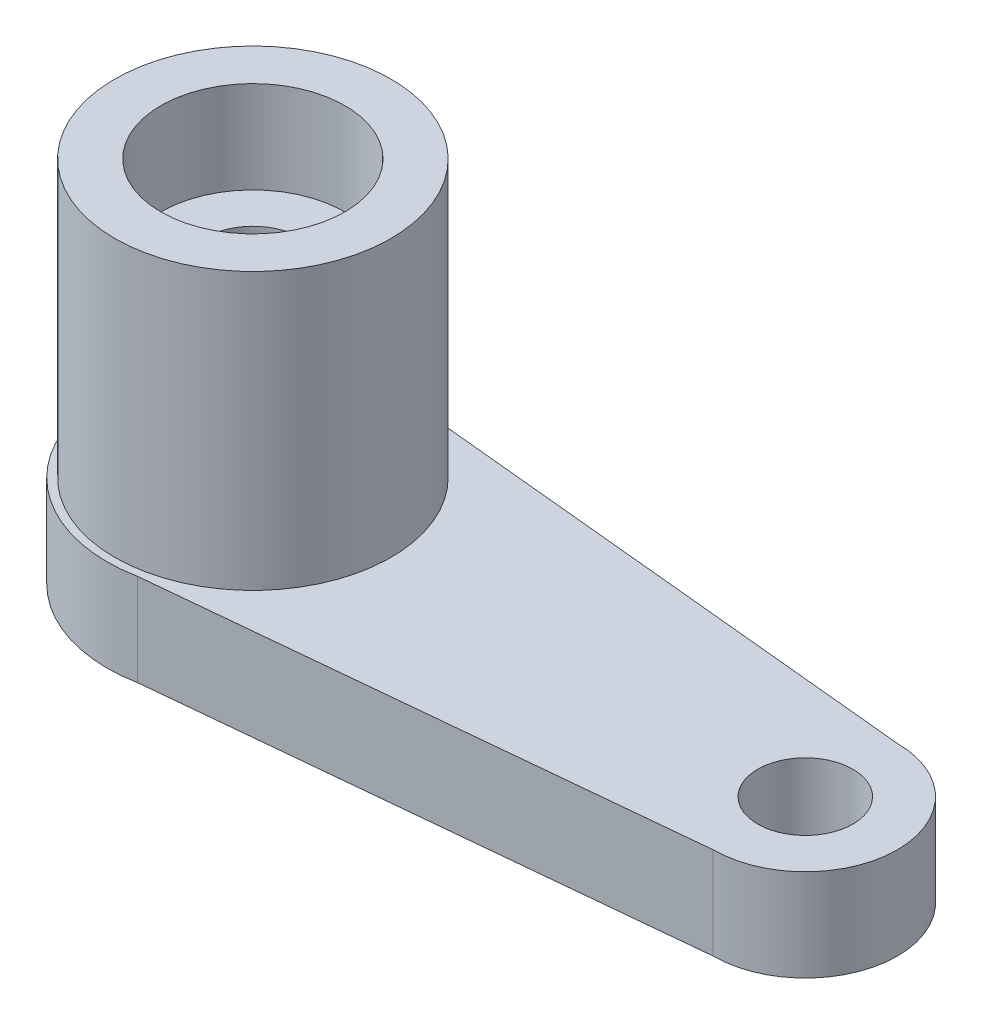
SolidWorks part; units mm, degrees
ref_plane "Front Plane" through (0, 0, 0) normal (0, 0, 1) x (1, 0, 0)
ref_plane "Top Plane" through (0, 0, 0) normal (0, 1, 0) x (1, 0, 0)
ref_plane "Right Plane" through (0, 0, 0) normal (1, 0, 0) x (0, 0, -1)
sketch "Sketch1" plane through (0, 0, 0) normal (0, 1, 0) x (1, 0, 0)
  line L0 (0, 0) -> (18, 0) construction
  line L1 (0.9, 4.664) -> (18, 3)
  line L2 (0.9, -4.664) -> (18, -3)
  arc A0 (0.9, 4.664) -> (0.9, -4.664) centre (0, 0) ccw
  arc A1 (18, -3) -> (18, 3) centre (18, 0) ccw
  point P4 (0, 0)
  dimension "D1" = 9.5
  dimension "D3" = 6
  dimension "D2" = 18
  dimension "D4" = 0.9
  dimension "D5" = 0.9
extrude "Boss-Extrude1" add sketch "Sketch1" along normal blind 3 contours A0 L2 A1 L1
sketch "Sketch2" plane through (0, 3, 0) normal (0, 1, 0) x (1, 0, 0)
  circle A0 centre (18, 0) radius 1.55
  dimension "D1" = 3.1
extrude "Cut-Extrude1" cut sketch "Sketch2" against normal up to next
sketch "Sketch3" plane through (0, 3, 0) normal (0, 1, 0) x (1, 0, 0)
  circle A0 centre (0, 0) radius 4.5
  dimension "D1" = 9
extrude "Boss-Extrude2" add sketch "Sketch3" along normal blind 9
sketch "Sketch4" plane through (0, 0, 0) normal (0, -1, 0) x (1, 0, 0)
  circle A0 centre (0, 0) radius 3
  dimension "D1" = 6
extrude "Cut-Extrude2" cut sketch "Sketch4" against normal blind 2.5
sketch "Sketch5" plane through (0, 12, 0) normal (0, 1, 0) x (1, 0, 0)
  circle A0 centre (0, 0) radius 3
  dimension "D1" = 6
extrude "Cut-Extrude3" cut sketch "Sketch5" against normal blind 3
sketch "Sketch6" plane through (0, 9, 0) normal (0, 1, 0) x (1, 0, 0)
  circle A0 centre (0, 0) radius 1.55
  dimension "D1" = 3.1
extrude "Cut-Extrude4" cut sketch "Sketch6" against normal up to next
